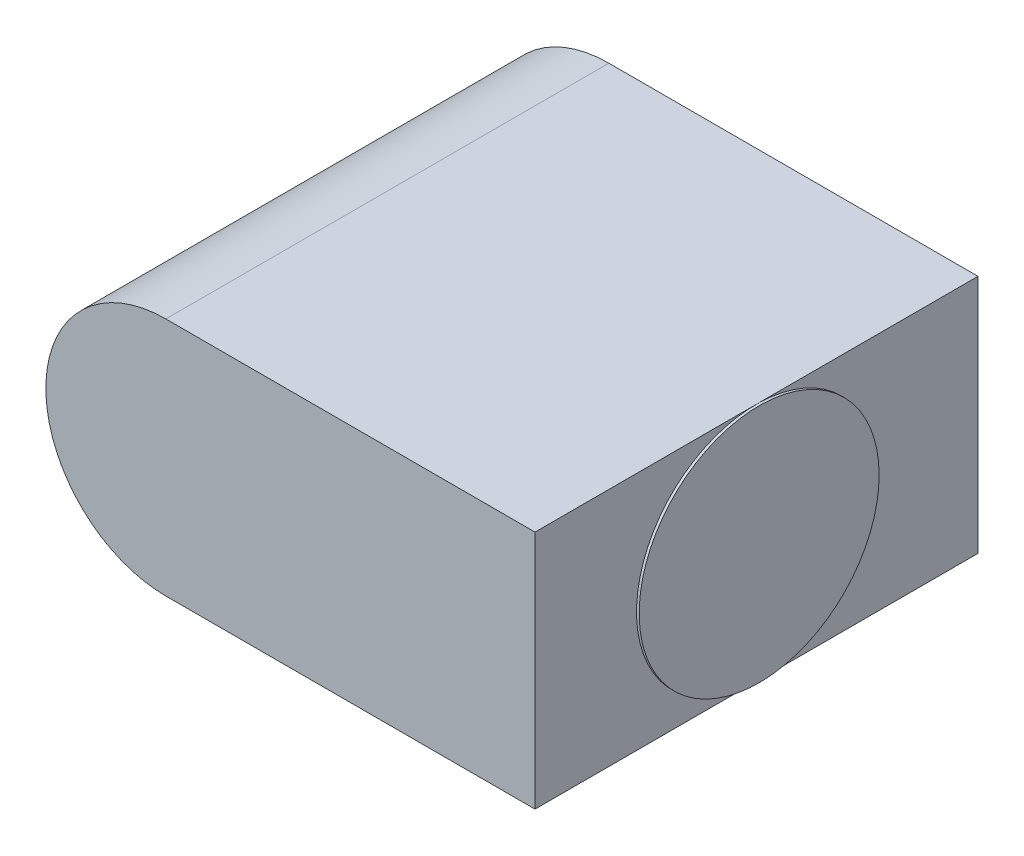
SolidWorks part; units mm, degrees
ref_plane "Front Plane" through (0, 0, 0) normal (0, 0, 1) x (1, 0, 0)
ref_plane "Top Plane" through (0, 0, 0) normal (0, 1, 0) x (1, 0, 0)
ref_plane "Right Plane" through (0, 0, 0) normal (1, 0, 0) x (0, 0, -1)
sketch "Sketch1" plane through (0, 0, 0) normal (0, 0, 1) x (1, 0, 0)
  line L1 (0, 22.75) -> (70, 22.75)
  line L3 (0, -22.75) -> (70, -22.75)
  line L4 (70, 22.75) -> (70, -22.75)
  arc A0 (0, 22.75) -> (0, -22.75) centre (0, 0) ccw
  dimension "D1" = 45.5
  dimension "D2" = 70
extrude "Boss-Extrude1" add sketch "Sketch1" against normal blind 84
sketch "Sketch2" plane through (70, 0, 0) normal (1, 0, 0) x (0, 0, -1)
  line L0 (42, 22.75) -> (42, -22.75) construction
  line L1 (84, 22.75) -> (0, 22.75) construction
  line L2 (84, -22.75) -> (0, -22.75) construction
  circle A0 centre (42, 0) radius 22.75
extrude "Boss-Extrude2" add sketch "Sketch2" along normal blind 0.5 separate body
